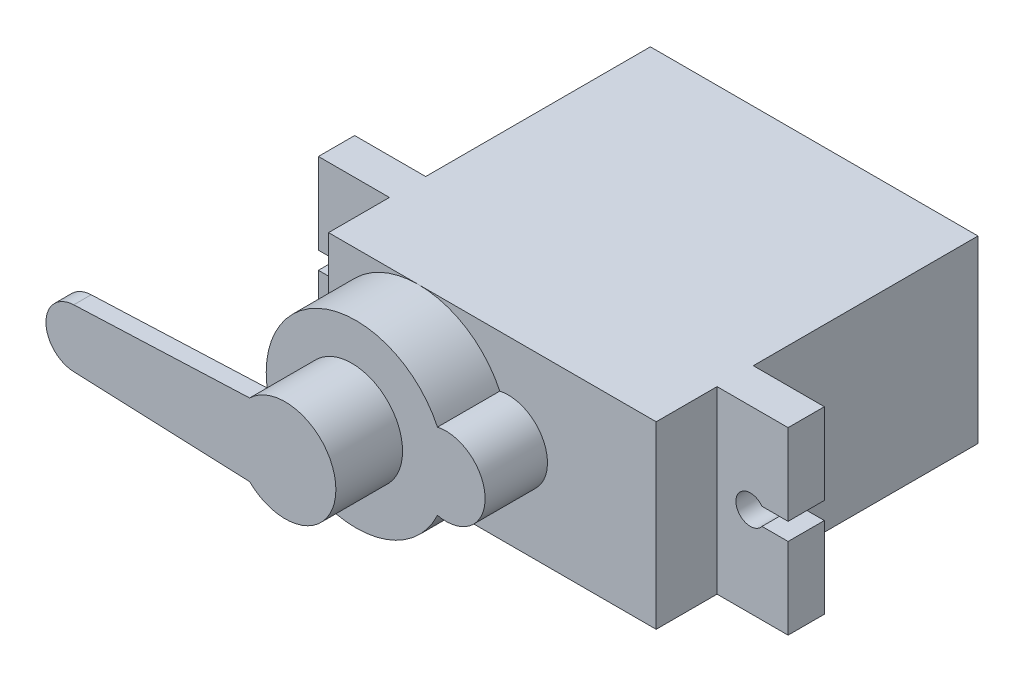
SolidWorks part; units mm, degrees
ref_plane "Ebene vorne" through (0, 0, 0) normal (0, 0, 1) x (1, 0, 0)
ref_plane "Ebene oben" through (0, 0, 0) normal (0, 1, 0) x (1, 0, 0)
ref_plane "Ebene rechts" through (0, 0, 0) normal (1, 0, 0) x (0, 0, -1)
sketch "Skizze1" plane through (0, 0, 0) normal (0, 0, 1) x (1, 0, 0)
  line L0 (0, -55) -> (0, 55) construction
  line L1 (-11.3, 6.2) -> (11.3, 6.2)
  line L2 (-11.3, 6.2) -> (-11.3, -6.2)
  line L3 (-11.3, -6.2) -> (11.3, -6.2)
  line L4 (11.3, 6.2) -> (11.3, -6.2)
  line L5 (55, 0) -> (-55, 0) construction
  point P4 (0, 6.2)
  point P9 (11.3, 0)
  dimension "D1" = 22.6
  dimension "D2" = 12.4
extrude "Aufsatz-Linear austragen1" add sketch "Skizze1" along normal blind 22.2
sketch "Skizze2" plane through (0, 0, 22.2) normal (0, 0, 1) x (1, 0, 0)
  line L0 (12.21, 0) -> (-12.21, 0) construction
  line L1 (11.3, 6.2) -> (-11.3, 6.2) construction
  line L2 (-11.3, 6.2) -> (-11.3, -6.2) construction
  circle A0 centre (-5.1, 0) radius 6.2
extrude "Aufsatz-Linear austragen2" add sketch "Skizze2" along normal blind 4.3
sketch "Skizze3" plane through (0, 0, 22.2) normal (0, 0, 1) x (1, 0, 0)
  line L0 (12.43, 0) -> (-12.43, 0) construction
  circle A0 centre (1.1, 0) radius 2.7
  circle A1 centre (-5.1, 0) radius 6.2 construction
  dimension "D1" = 5.4
extrude "Aufsatz-Linear austragen3" add sketch "Skizze3" along normal up to surface (4.3 mm away)
sketch "Skizze4" plane through (0, 0, 26.5) normal (0, 0, 1) x (1, 0, 0)
  line L0 (12.43, 0) -> (-12.43, 0) construction
  circle A0 centre (-5.3947, 0) radius 3.5
  dimension "D1" = 7
extrude "Aufsatz-Linear austragen4" add sketch "Skizze4" along normal blind 4.6
sketch "Skizze5" plane through (0, 0, 31.1) normal (0, 0, 1) x (1, 0, 0)
  line L4 (-7.8442, 2.5) -> (-19.9754, 2)
  line L5 (-19.9754, -2) -> (-7.8442, -2.5)
  line L6 (-7.8442, -2.5) -> (-7.8442, 2.5)
  line L7 (12.43, 0) -> (-12.43, 0) construction
  circle A0 centre (-5.3947, 0) radius 3.5 construction
  arc A2 (-19.9754, 2) -> (-19.9754, -2) centre (-19.893, 0) ccw
  circle A3 centre (-5.3947, 0) radius 3.5 construction
  point P14 (-21.8947, 0)
  dimension "D3" = 16.5
  dimension "D1" = 4
  dimension "D2" = 5
extrude "Aufsatz-Linear austragen5" add sketch "Skizze5" against normal blind 1.2
sketch "Skizze6" plane through (0, 0, 0) normal (0, 0, 1) x (1, 0, 0)
  line L0 (-11.3, 6.2) -> (-16.2, 6.2)
  line L1 (-16.2, 6.2) -> (-16.2, 0.6)
  line L2 (-16.2, 0.6) -> (-13.2, 0.6)
  line L3 (-13.2, 0.6) -> (-13.2, -0.6)
  line L4 (-13.2, -0.6) -> (-16.2, -0.6)
  line L5 (-16.2, -0.6) -> (-16.2, -6.2)
  line L6 (-16.2, -6.2) -> (-11.3, -6.2)
  line L7 (-11.3, -6.2) -> (-11.3, 6.2)
  line L8 (17.105, 0) -> (-17.105, 0) construction
  line L9 (-11.3, -6.2) -> (-5.1, -6.2) construction
  point P3 (-13.2, 0)
  dimension "D1" = 4.9
  dimension "D2" = 1.2
  dimension "D3" = 3
extrude "Aufsatz-Linear austragen6" add sketch "Skizze6" along normal blind 2.5 from offset 15.5
sketch "Skizze7" plane through (0, 0, 18) normal (0, 0, 1) x (1, 0, 0)
  circle A0 centre (-13.6, 0) radius 1
  dimension "D1" = 2
  dimension "D2" = 13.6
extrude "Schnitt-Linear austragen1" cut sketch "Skizze7" against normal up to surface (2.5 mm away)
mirror "Spiegeln1" about plane through (0, 0, 0) normal (1, 0, 0) of "Schnitt-Linear austragen1", "Aufsatz-Linear austragen6"
sketch "Skizze8" plane through (-11.3, 0, 0) normal (-1, 0, 0) x (0, 0, 1)
  line L0 (17.105, 0) -> (-17.105, 0) construction
  line L1 (4, 1.75) -> (5.5, 1.75)
  line L2 (4, 1.75) -> (4, -1.75)
  line L3 (4, -1.75) -> (5.5, -1.75)
  line L4 (5.5, 1.75) -> (5.5, -1.75)
  line L5 (0, 6.2) -> (0, -6.2) construction
  point P6 (4, 0)
  dimension "D1" = 3.5
  dimension "D2" = 1.5
  dimension "D3" = 4
extrude "Aufsatz-Linear austragen7" add sketch "Skizze8" along normal blind 2.5
